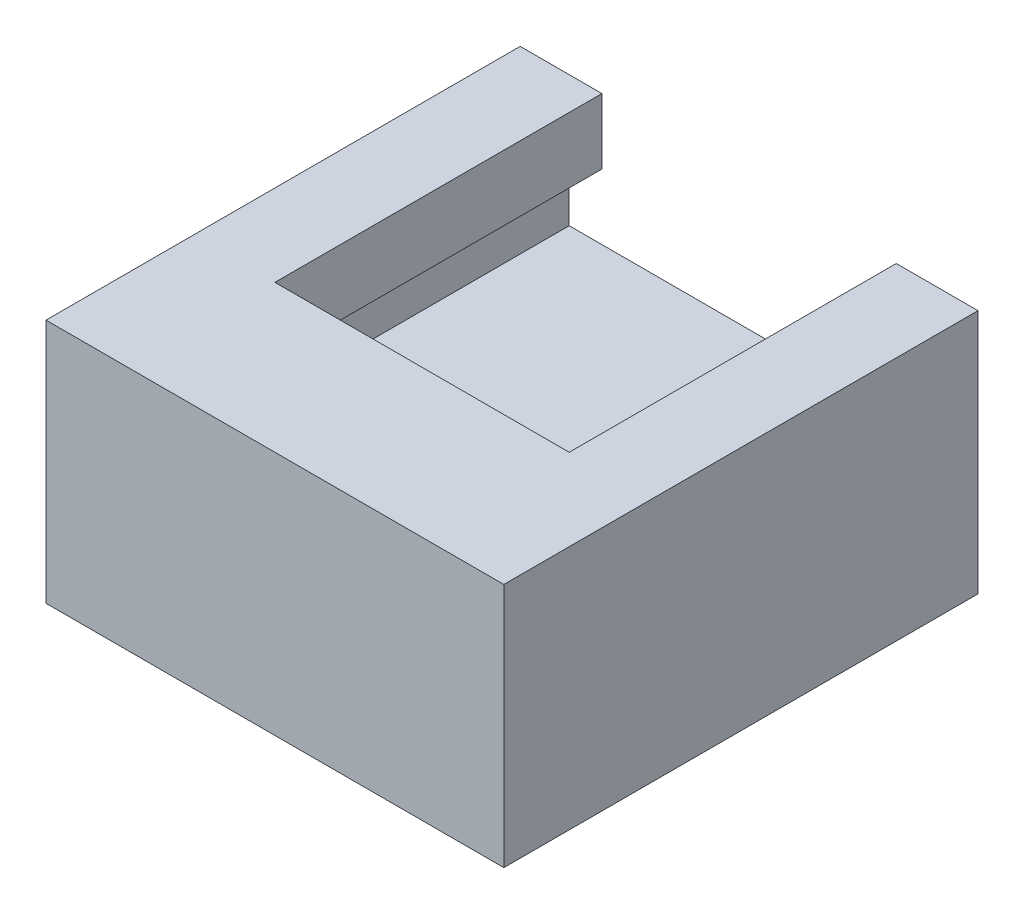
SolidWorks part; units mm, degrees
ref_plane "Front Plane" through (0, 0, 0) normal (0, 0, 1) x (1, 0, 0)
ref_plane "Top Plane" through (0, 0, 0) normal (0, 1, 0) x (1, 0, 0)
ref_plane "Right Plane" through (0, 0, 0) normal (1, 0, 0) x (0, 0, -1)
sketch "Sketch6" plane through (0, 0, 0) normal (0, 1, 0) x (1, 0, 0)
  line L1 (0, 0) -> (14, 0)
  line L2 (0, 0) -> (0, 10)
  line L3 (0, 10) -> (14, 10)
  line L4 (14, 0) -> (14, 10)
  dimension "D1" = 14
  dimension "D2" = 10
extrude "Boss-Extrude4" add sketch "Sketch6" along normal blind 3.5
sketch "Sketch7" plane through (0, 0, 0) normal (0, 0, 1) x (1, 0, 0)
  line L0 (0, 3.5) -> (0, 7.5)
  line L1 (0, 7.5) -> (2.5, 7.5)
  line L2 (2.5, 7.5) -> (2.5, 5.5)
  line L5 (0, 3.5) -> (14, 3.5) construction
  line L6 (1.5, 3.5) -> (0, 3.5)
  line L7 (7, 1.8274) -> (7, -2.1726) construction
  line L8 (2.5, 5.5) -> (2, 5.5)
  line L15 (1.5, 5) -> (1.5, 3.5)
  line L16 (12.5, 5) -> (12.5, 3.5)
  line L17 (11.5, 5.5) -> (12, 5.5)
  line L18 (12.5, 3.5) -> (14, 3.5)
  line L19 (11.5, 7.5) -> (11.5, 5.5)
  line L20 (14, 7.5) -> (11.5, 7.5)
  line L21 (14, 3.5) -> (14, 7.5)
  line L22 (2, 5.5) -> (1.5, 5)
  line L23 (12, 5.5) -> (12.5, 5)
  point P5 (12.5, 5.5)
  point P11 (1.5, 5.5)
  point P16 (7, 3.5)
  dimension "D3" = 2
  dimension "D1" = 5.5
  dimension "D2" = 2
  dimension "D4" = 4.5
extrude "Boss-Extrude5" add sketch "Sketch7" against normal up to surface (10 mm away)
sketch "Sketch8" plane through (0, 0, 0) normal (0, 0, 1) x (1, 0, 0)
  line L1 (0, 7.5) -> (14, 7.5)
  line L2 (0, 7.5) -> (0, 0)
  line L3 (0, 0) -> (14, 0)
  line L4 (14, 7.5) -> (14, 0)
extrude "Boss-Extrude6" add sketch "Sketch8" along normal blind 4.5 contours L2 L1 L4 L3
sketch "Sketch9" plane through (0, 0, 0) normal (0, -1, 0) x (1, 0, 0)
  line L0 (5.75, 5.75) -> (5.75, 4.5)
  line L11 (4.75, 7) -> (9.25, 7)
  line L12 (5.25, 5.75) -> (5.75, 5.75)
  line L13 (9.25, 7) -> (9.25, 6.25)
  line L14 (8.75, 5.75) -> (8.25, 5.75)
  line L15 (8.25, 5.75) -> (8.25, 4.5)
  line L16 (8.25, 4.5) -> (5.75, 4.5)
  line L17 (7, 4.3234) -> (7, 6.2823) construction
  line L18 (0, 4.5) -> (14, 4.5) construction
  line L19 (4.75, 7) -> (4.75, 6.25)
  line L20 (9.25, 6.25) -> (8.75, 5.75)
  line L21 (4.75, 6.25) -> (5.25, 5.75)
  point P1 (7, 4.5)
  point P3 (4.75, 5.75)
  point P5 (7, 7)
  point P20 (9.25, 5.75)
  point P29 (7, 4.5)
  dimension "D9" = 1.25
  dimension "D10" = 2.25
  dimension "D11" = 1.25
  dimension "D12" = 1.25
extrude "Boss-Extrude7" [suppressed] add sketch "Sketch9" against normal blind 6
